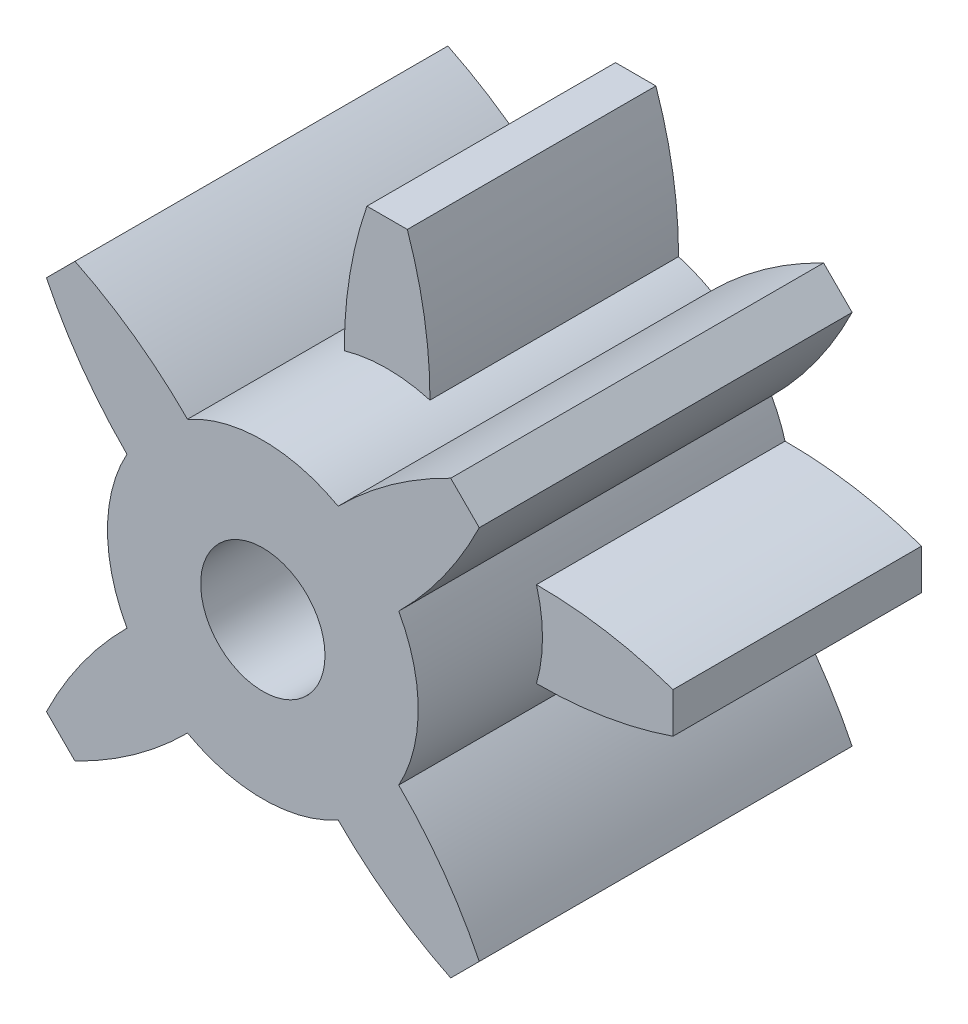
SolidWorks part; units mm, degrees
ref_plane "前基準面" through (0, 0, 0) normal (0, 0, 1) x (1, 0, 0)
ref_plane "上基準面" through (0, 0, 0) normal (0, 1, 0) x (1, 0, 0)
ref_plane "右基準面" through (0, 0, 0) normal (1, 0, 0) x (0, 0, -1)
sketch "草圖1" plane through (0, 0, 0) normal (0, 0, 1) x (1, 0, 0)
  line L0 (0, 0) -> (-7.8217, 49.3844) construction
  line L1 (0, 0) -> (7.8217, 49.3844) construction
  line L2 (0, 0) -> (0, 50) construction
  line L3 (0, 0) -> (-2.0673, 39.4459) construction
  line L4 (0, 0) -> (2.0673, 39.4459) construction
  line L5 (0, 63) -> (-6.8883, 46.3702) construction
  line L6 (-6.6046, 49.5619) -> (-7.8217, 49.3844)
  line L7 (0, 63) -> (6.8883, 46.3702) construction
  line L8 (0, 63) -> (-3.4455, 50.9842) construction
  line L9 (0, 63) -> (3.4455, 50.9842) construction
  line L10 (-1.625, 40) -> (1.625, 40)
  line L11 (6.6046, 49.5619) -> (7.8217, 49.3844)
  line L12 (-17.4125, 47.8856) -> (-15.1144, 45.5875)
  line L13 (-23, 64.625) -> (-23, 61.375)
  line L14 (-15.1144, 80.4125) -> (-17.4125, 78.1144)
  line L15 (1.625, 86) -> (-1.625, 86)
  line L16 (17.4125, 78.1144) -> (15.1144, 80.4125)
  line L17 (23, 61.375) -> (23, 64.625)
  line L18 (15.1144, 45.5875) -> (17.4125, 47.8856)
  circle A0 centre (0, 0) radius 39.5
  circle A1 centre (0, 0) radius 45 construction
  circle A2 centre (0, 0) radius 50 construction
  circle A3 centre (0, 0) radius 7
  arc A4 (-6.6046, 49.5619) -> (-2.0673, 39.4459) centre (-40.3648, 28.3439) cw
  arc A5 (6.6046, 49.5619) -> (2.0673, 39.4459) centre (40.3648, 28.3439) ccw
  circle A6 centre (0, 63) radius 5
  circle A7 centre (0, 63) radius 12.5
  circle A8 centre (0, 63) radius 18 construction
  arc A9 (-3.4455, 50.9842) -> (-1.625, 40) centre (29.8672, 50.8623) ccw
  arc A10 (3.4455, 50.9842) -> (1.625, 40) centre (-29.8672, 50.8623) cw
  arc A11 (-10.9327, 56.9399) -> (-17.4125, 47.8856) centre (12.5367, 33.2981) ccw
  arc A12 (-6.0601, 52.0673) -> (-15.1144, 45.5875) centre (-29.7019, 75.5367) cw
  arc A13 (-12.0158, 66.4455) -> (-23, 64.625) centre (-12.1377, 33.1328) ccw
  arc A14 (-12.0158, 59.5545) -> (-23, 61.375) centre (-12.1377, 92.8672) cw
  arc A15 (-6.0601, 73.9327) -> (-15.1144, 80.4125) centre (-29.7019, 50.4633) ccw
  arc A16 (-10.9327, 69.0601) -> (-17.4125, 78.1144) centre (12.5367, 92.7019) cw
  arc A17 (3.4455, 75.0158) -> (1.625, 86) centre (-29.8672, 75.1377) ccw
  arc A18 (-3.4455, 75.0158) -> (-1.625, 86) centre (29.8672, 75.1377) cw
  arc A19 (10.9327, 69.0601) -> (17.4125, 78.1144) centre (-12.5367, 92.7019) ccw
  arc A20 (6.0601, 73.9327) -> (15.1144, 80.4125) centre (29.7019, 50.4633) cw
  arc A21 (12.0158, 59.5545) -> (23, 61.375) centre (12.1377, 92.8672) ccw
  arc A22 (12.0158, 66.4455) -> (23, 64.625) centre (12.1377, 33.1328) cw
  arc A23 (6.0601, 52.0673) -> (15.1144, 45.5875) centre (29.7019, 75.5367) ccw
  arc A24 (10.9327, 56.9399) -> (17.4125, 47.8856) centre (-12.5367, 33.2981) cw
  point P19 (0, 40)
  point P73 (0, 63)
  dimension "D1" = 79
  dimension "D2" = 90
  dimension "D3" = 100
  dimension "D6" = 14
  dimension "D9" = 25
  dimension "D10" = 10
  dimension "D4" = 18
  dimension "D5" = 6
  dimension "D7" = 1.23
  dimension "D8" = 63
  dimension "D11" = 45
  dimension "D12" = 32
  dimension "D13" = 3.25
  dimension "D14" = 23
  dimension "D15" = 8
extrude "填料-伸長1" add sketch "草圖1" along normal blind 30 contours A7 A6 | A16 A7 A15 L14 | A18 A7 A17 L15 | A20 A7 A19 L16 | A22 A7 A21 L17 | A24 A7 A23 L18 | A10 A7 A9 L10 | A12 A7 A11 L12 | A14 A7 A13 L13
sketch "草圖3" plane through (0, 0, 30) normal (0, 0, 1) x (1, 0, 0)
  line L8 (17.4125, 78.1144) -> (15.1144, 80.4125)
  line L9 (1.625, 86) -> (-1.625, 86)
  line L10 (-15.1144, 80.4125) -> (-17.4125, 78.1144)
  line L11 (-23, 64.625) -> (-23, 61.375)
  line L12 (-17.4125, 47.8856) -> (-15.1144, 45.5875)
  line L13 (-1.625, 40) -> (1.625, 40)
  line L14 (15.1144, 45.5875) -> (17.4125, 47.8856)
  line L15 (23, 61.375) -> (23, 64.625)
  line L16 (17.4125, 78.1144) -> (15.1144, 80.4125)
  line L17 (1.625, 86) -> (-1.625, 86)
  line L18 (-15.1144, 80.4125) -> (-17.4125, 78.1144)
  line L19 (-23, 64.625) -> (-23, 61.375)
  line L20 (-17.4125, 47.8856) -> (-15.1144, 45.5875)
  line L21 (-1.625, 40) -> (1.625, 40)
  line L22 (15.1144, 45.5875) -> (17.4125, 47.8856)
  line L23 (23, 61.375) -> (23, 64.625)
  circle A0 centre (0, 63) radius 12.5
  arc A24 (12.0158, 66.4455) -> (10.9327, 69.0601) centre (0, 63) ccw
  arc A25 (10.9327, 69.0601) -> (17.4125, 78.1144) centre (-12.5367, 92.7019) ccw
  arc A26 (15.1144, 80.4125) -> (6.0601, 73.9327) centre (29.7019, 50.4633) ccw
  arc A27 (6.0601, 73.9327) -> (3.4455, 75.0158) centre (0, 63) ccw
  arc A28 (3.4455, 75.0158) -> (1.625, 86) centre (-29.8672, 75.1377) ccw
  arc A29 (-1.625, 86) -> (-3.4455, 75.0158) centre (29.8672, 75.1377) ccw
  arc A30 (-3.4455, 75.0158) -> (-6.0601, 73.9327) centre (0, 63) ccw
  arc A31 (-6.0601, 73.9327) -> (-15.1144, 80.4125) centre (-29.7019, 50.4633) ccw
  arc A32 (-17.4125, 78.1144) -> (-10.9327, 69.0601) centre (12.5367, 92.7019) ccw
  arc A33 (-10.9327, 69.0601) -> (-12.0158, 66.4455) centre (0, 63) ccw
  arc A34 (-12.0158, 66.4455) -> (-23, 64.625) centre (-12.1377, 33.1328) ccw
  arc A35 (-23, 61.375) -> (-12.0158, 59.5545) centre (-12.1377, 92.8672) ccw
  arc A36 (-12.0158, 59.5545) -> (-10.9327, 56.9399) centre (0, 63) ccw
  arc A37 (-10.9327, 56.9399) -> (-17.4125, 47.8856) centre (12.5367, 33.2981) ccw
  arc A38 (-15.1144, 45.5875) -> (-6.0601, 52.0673) centre (-29.7019, 75.5367) ccw
  arc A39 (-6.0601, 52.0673) -> (-3.4455, 50.9842) centre (0, 63) ccw
  arc A40 (-3.4455, 50.9842) -> (-1.625, 40) centre (29.8672, 50.8623) ccw
  arc A41 (1.625, 40) -> (3.4455, 50.9842) centre (-29.8672, 50.8623) ccw
  arc A42 (3.4455, 50.9842) -> (6.0601, 52.0673) centre (0, 63) ccw
  arc A43 (6.0601, 52.0673) -> (15.1144, 45.5875) centre (29.7019, 75.5367) ccw
  arc A44 (17.4125, 47.8856) -> (10.9327, 56.9399) centre (-12.5367, 33.2981) ccw
  arc A45 (10.9327, 56.9399) -> (12.0158, 59.5545) centre (0, 63) ccw
  arc A46 (12.0158, 59.5545) -> (23, 61.375) centre (12.1377, 92.8672) ccw
  arc A47 (23, 64.625) -> (12.0158, 66.4455) centre (12.1377, 33.1328) ccw
  arc A48 (12.0158, 66.4455) -> (10.9327, 69.0601) centre (0, 63) ccw
  arc A49 (10.9327, 69.0601) -> (17.4125, 78.1144) centre (-12.5367, 92.7019) ccw
  arc A50 (15.1144, 80.4125) -> (6.0601, 73.9327) centre (29.7019, 50.4633) ccw
  arc A51 (6.0601, 73.9327) -> (3.4455, 75.0158) centre (0, 63) ccw
  arc A52 (3.4455, 75.0158) -> (1.625, 86) centre (-29.8672, 75.1377) ccw
  arc A53 (-1.625, 86) -> (-3.4455, 75.0158) centre (29.8672, 75.1377) ccw
  arc A54 (-3.4455, 75.0158) -> (-6.0601, 73.9327) centre (0, 63) ccw
  arc A55 (-6.0601, 73.9327) -> (-15.1144, 80.4125) centre (-29.7019, 50.4633) ccw
  arc A56 (-17.4125, 78.1144) -> (-10.9327, 69.0601) centre (12.5367, 92.7019) ccw
  arc A57 (-10.9327, 69.0601) -> (-12.0158, 66.4455) centre (0, 63) ccw
  arc A58 (-12.0158, 66.4455) -> (-23, 64.625) centre (-12.1377, 33.1328) ccw
  arc A59 (-23, 61.375) -> (-12.0158, 59.5545) centre (-12.1377, 92.8672) ccw
  arc A60 (-12.0158, 59.5545) -> (-10.9327, 56.9399) centre (0, 63) ccw
  arc A61 (-10.9327, 56.9399) -> (-17.4125, 47.8856) centre (12.5367, 33.2981) ccw
  arc A62 (-15.1144, 45.5875) -> (-6.0601, 52.0673) centre (-29.7019, 75.5367) ccw
  arc A63 (-6.0601, 52.0673) -> (-3.4455, 50.9842) centre (0, 63) ccw
  arc A64 (-3.4455, 50.9842) -> (-1.625, 40) centre (29.8672, 50.8623) ccw
  arc A65 (1.625, 40) -> (3.4455, 50.9842) centre (-29.8672, 50.8623) ccw
  arc A66 (3.4455, 50.9842) -> (6.0601, 52.0673) centre (0, 63) ccw
  arc A67 (6.0601, 52.0673) -> (15.1144, 45.5875) centre (29.7019, 75.5367) ccw
  arc A68 (17.4125, 47.8856) -> (10.9327, 56.9399) centre (-12.5367, 33.2981) ccw
  arc A69 (10.9327, 56.9399) -> (12.0158, 59.5545) centre (0, 63) ccw
  arc A70 (12.0158, 59.5545) -> (23, 61.375) centre (12.1377, 92.8672) ccw
  arc A71 (23, 64.625) -> (12.0158, 66.4455) centre (12.1377, 33.1328) ccw
  dimension "D1" = 0
extrude "除料-伸長1" cut sketch "草圖3" against normal blind 10 contours A0 M47 M48 M49 | A0 M63 M64 M65 | A0 M39 M40 M41 | A0 M55 M56 M57
sketch "草圖4" plane through (0, 0, 0) normal (1, 0, 0) x (0, 0, -1)
  line L0 (0, 58) -> (0, 68) construction
  line L1 (-30, 68) -> (-30, 58) construction
  line L2 (0, 58) -> (0, 68)
  line L3 (-30, 68) -> (-30, 58)
  line L4 (-30, 63) -> (0, 63) construction
